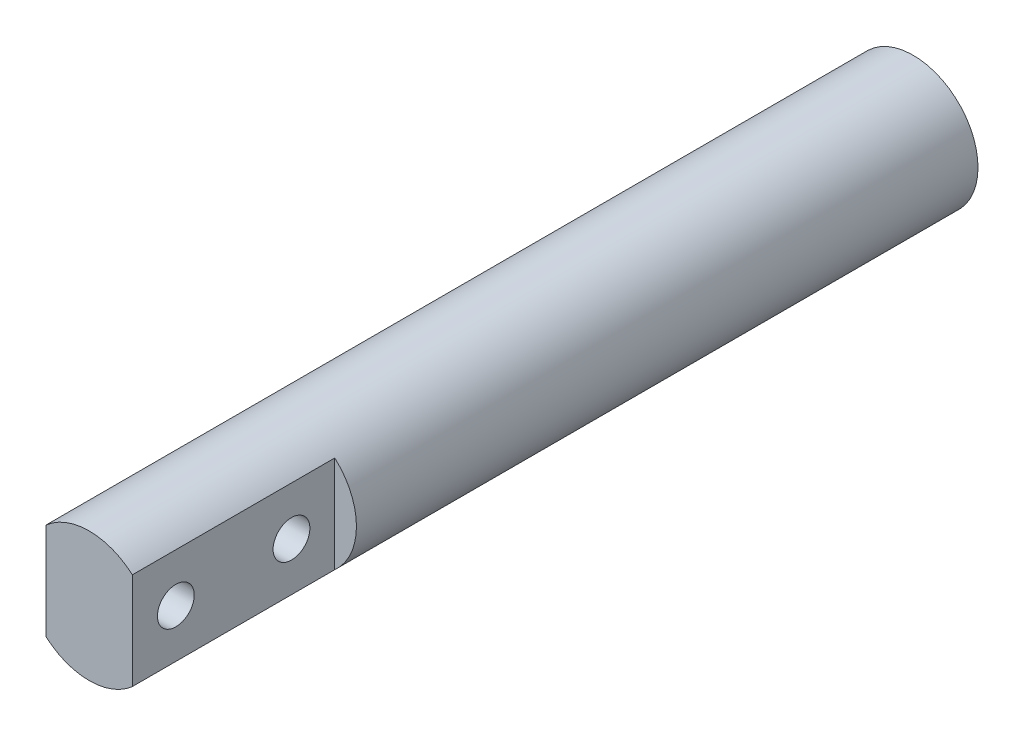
SolidWorks part; units mm, degrees
ref_plane "Front Plane" through (0, 0, 0) normal (0, 0, 1) x (1, 0, 0)
ref_plane "Top Plane" through (0, 0, 0) normal (0, 1, 0) x (1, 0, 0)
ref_plane "Right Plane" through (0, 0, 0) normal (1, 0, 0) x (0, 0, -1)
sketch "Sketch1" plane through (0, 0, 0) normal (0, 0, 1) x (1, 0, 0)
  circle A0 centre (0, 0) radius 7.1183
  dimension "D1" = 14.2367
extrude "Extrude1" add sketch "Sketch1" against normal blind 90.4748
sketch "Sketch2" plane through (0, 0, 0) normal (0, 0, 1) x (1, 0, 0)
  line L1 (-8.0704, 6.6538) -> (-4.7435, 6.6538)
  line L2 (-8.0704, 6.6538) -> (-8.0704, -6.3871)
  line L3 (-8.0704, -6.3871) -> (-4.7434, -6.3871)
  line L4 (-4.7435, 6.6538) -> (-4.7434, -6.3871)
  line L5 (4.7371, 6.8735) -> (9.3822, 6.8735)
  line L6 (4.7371, 6.8735) -> (4.7371, -6.3871)
  line L7 (4.7371, -6.3871) -> (9.3822, -6.3871)
  line L8 (9.3822, 6.8735) -> (9.3822, -6.3871)
  dimension "D1" = 4.7371
  dimension "D2" = 4.7435
extrude "Cut-Extrude1" cut sketch "Sketch2" against normal blind 22.225
hole_wizard "#10-32 Tapped Hole1" positions "Sketch4" profile "Sketch3" tap size "#10-32" standard "Ansi Inch"
sketch "Sketch4" plane through (-4.7435, 0, 0) normal (-1, 0, 0) x (0, 0, 1)
  line L0 (0, -5.3076) -> (0, 5.3076) construction
  line L1 (0, 0) -> (-46.509, 0) construction
  point P0 (-17.4752, 0)
  point P1 (-4.7752, 0)
  dimension "D1" = 4.7752
  dimension "D2" = 12.7
sketch "Sketch3" plane through (-4.7435, 0, -17.4752) normal (0, 1, 0) x (0, 0, 1)
  line L0 (0, 0) -> (0, 11.8618)
  line L1 (0, 11.8618) -> (2.0193, 11.8618)
  line L2 (2.0193, 11.8618) -> (2.0193, 0)
  line L5 (2.0193, 0) -> (0, 0)
  line L11 (0, -6.35) -> (0, 107.95) construction
  dimension "Thru Tap Drill Dia." = 4.0386
  dimension "Thru Tap Drill Depth" = 11.8618
